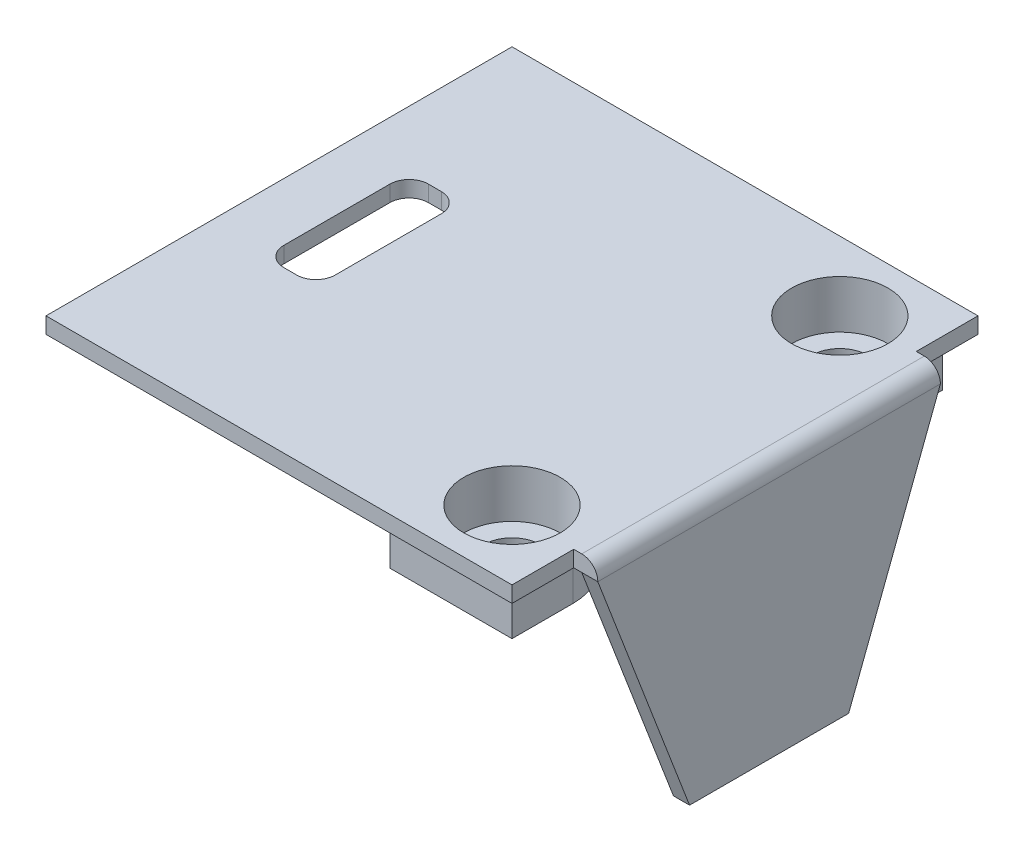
SolidWorks part; units mm, degrees
ref_plane "Ebene vorne" through (0, 0, 0) normal (0, 0, 1) x (1, 0, 0)
ref_plane "Ebene oben" through (0, 0, 0) normal (0, 1, 0) x (1, 0, 0)
ref_plane "Ebene rechts" through (0, 0, 0) normal (1, 0, 0) x (0, 0, -1)
sketch "Skizze1" plane through (0, 0, 0) normal (0, 1, 0) x (1, 0, 0)
  line L1 (14.5, 14.5) -> (-14.5, 14.5)
  line L2 (14.5, 14.5) -> (14.5, -14.5)
  line L3 (14.5, -14.5) -> (-14.5, -14.5)
  line L4 (-14.5, 14.5) -> (-14.5, -14.5)
  line L5 (14.5, 14.5) -> (-14.5, -14.5) construction
  line L6 (14.5, -14.5) -> (-14.5, 14.5) construction
  point P0 (0, 0)
  dimension "D1" = 29
  dimension "D2" = 29
extrude "Aufsatz-Linear austragen1" add sketch "Skizze1" along normal blind 1
sketch "Skizze2" plane through (14.5, 0, 0) normal (1, 0, 0) x (0, 0, -1)
  line L0 (0, 0) -> (0, -13.9) construction
  line L1 (4.95, -13.9) -> (-4.95, -13.9)
  line L2 (-4.95, -13.9) -> (-10.3732, 1)
  line L3 (-14.5, 1) -> (14.5, 1) construction
  line L4 (-10.3732, 1) -> (10.3732, 1)
  line L5 (10.3732, 1) -> (4.95, -13.9)
  point P6 (0, -13.9)
  dimension "D1" = 14.9
  dimension "D2" = 9.9
  dimension "D3" = 110
  dimension "D4" = 110
extrude "Aufsatz-Linear austragen2" add sketch "Skizze2" along normal blind 1.5
sketch "Skizze4" plane through (16, 0, 0) normal (1, 0, 0) x (0, 0, -1)
  line L0 (10.6596, 0) -> (4.95, -14.9)
  line L1 (4.95, -14.9) -> (-4.95, -14.9)
  line L2 (10.6596, 1) -> (-10.6596, 1)
  line L3 (10.3732, 1) -> (-10.3732, 1) construction
  line L4 (-14.5, 1) -> (-10.3732, 1) construction
  line L6 (-10.6596, 1) -> (-10.6596, 0)
  line L7 (-10.6596, 0) -> (-4.95, -14.9)
  line L8 (0, 0) -> (0, -14.9) construction
  line L10 (10.6596, 1) -> (10.6596, 0)
  point P15 (0, 1)
  dimension "D2" = 10.6596
  dimension "D3" = 1
extrude "Aufsatz-Linear austragen3" add sketch "Skizze4" against normal blind 1
sketch "Skizze5" plane through (15, 0, 0) normal (-1, 0, 0) x (0, 0, 1)
  line L0 (-10.3732, 1) -> (-10.6596, 1)
  line L1 (-10.6596, 1) -> (-10.6596, 0)
  line L2 (-10.6596, 0) -> (-10.0092, 0)
  line L3 (-10.3732, 1) -> (-4.95, -13.9) construction
  line L4 (-10.0092, 0) -> (-10.3732, 1)
  line L5 (0, 0) -> (0, -5.5348) construction
  line L6 (10.0092, 0) -> (10.3732, 1)
  line L7 (10.6596, 0) -> (10.0092, 0)
  line L8 (10.6596, 1) -> (10.6596, 0)
  line L9 (10.3732, 1) -> (10.6596, 1)
extrude "Aufsatz-Linear austragen4" add sketch "Skizze5" along normal up to surface (0.5 mm away)
sketch "Skizze6" plane through (0, 0, 0) normal (0, -1, 0) x (1, 0, 0)
  line L2 (13.4, 9.6) -> (13.4, 13.4)
  line L3 (13.4, 13.4) -> (5.8, 13.4)
  line L4 (5.8, 13.4) -> (5.8, 9.6)
  line L5 (-14.5, 14.5) -> (14.5, 14.5) construction
  line L6 (14.5, 14.5) -> (14.5, 10.6596) construction
  arc A0 (5.8, 9.6) -> (13.4, 9.6) centre (9.6, 9.6) ccw
  dimension "D1" = 1.1
  dimension "D2" = 1.1
  dimension "D3" = 7.6
extrude "Aufsatz-Linear austragen5" add sketch "Skizze6" along normal blind 3
sketch "Skizze7" plane through (0, 1, 0) normal (0, 1, 0) x (1, 0, 0)
  line L0 (-14.5, -14.5) -> (14.5, -14.5) construction
  line L1 (14.5, -14.5) -> (14.5, -10.6596) construction
  circle A0 centre (10.2, -10.2) radius 1.75
  point P6 (14.5, -12.5798)
  dimension "D1" = 4.3
  dimension "D2" = 4.3
  dimension "D3" = 3.5
extrude "Schnitt-Linear austragen1" cut sketch "Skizze7" against normal up to surface (4 mm away)
sketch "Skizze8" plane through (0, 1, 0) normal (0, 1, 0) x (1, 0, 0)
  circle A0 centre (10.2, -10.2) radius 3
  dimension "D1" = 6
extrude "Schnitt-Linear austragen2" cut sketch "Skizze8" against normal blind 3
mirror "Spiegeln1" about plane through (0, 0, 0) normal (0, 0, 1) of "Schnitt-Linear austragen2", "Schnitt-Linear austragen1", "Aufsatz-Linear austragen5"
sketch "Skizze9" plane through (0, 1, 0) normal (0, 1, 0) x (1, 0, 0)
  line L0 (0, 0) -> (-16.8496, 0) construction
  line L1 (-14.5, 14.5) -> (-14.5, -14.5) construction
  line L2 (-9.7, 4.5) -> (-8.9, 4.5)
  line L3 (-10.9, 3.3) -> (-10.9, -3.3)
  line L4 (-9.7, -4.5) -> (-8.9, -4.5)
  line L5 (-7.7, 3.3) -> (-7.7, -3.3)
  line L6 (-10.9, 4.5) -> (-7.7, -4.5) construction
  line L7 (-10.9, -4.5) -> (-7.7, 4.5) construction
  arc A0 (-10.9, -3.3) -> (-9.7, -4.5) centre (-9.7, -3.3) ccw
  arc A1 (-8.9, -4.5) -> (-7.7, -3.3) centre (-8.9, -3.3) ccw
  arc A2 (-8.9, 4.5) -> (-7.7, 3.3) centre (-8.9, 3.3) cw
  arc A3 (-9.7, 4.5) -> (-10.9, 3.3) centre (-9.7, 3.3) ccw
  point P3 (-9.3, 0)
  dimension "D4" = 1.2
  dimension "D1" = 3.2
  dimension "D2" = 9
  dimension "D3" = 3.6
extrude "Schnitt-Linear austragen4" cut sketch "Skizze9" against normal up to surface (1 mm away)
fillet "Verrundung1" radius 1 1 edges at (16, 1, 0)
